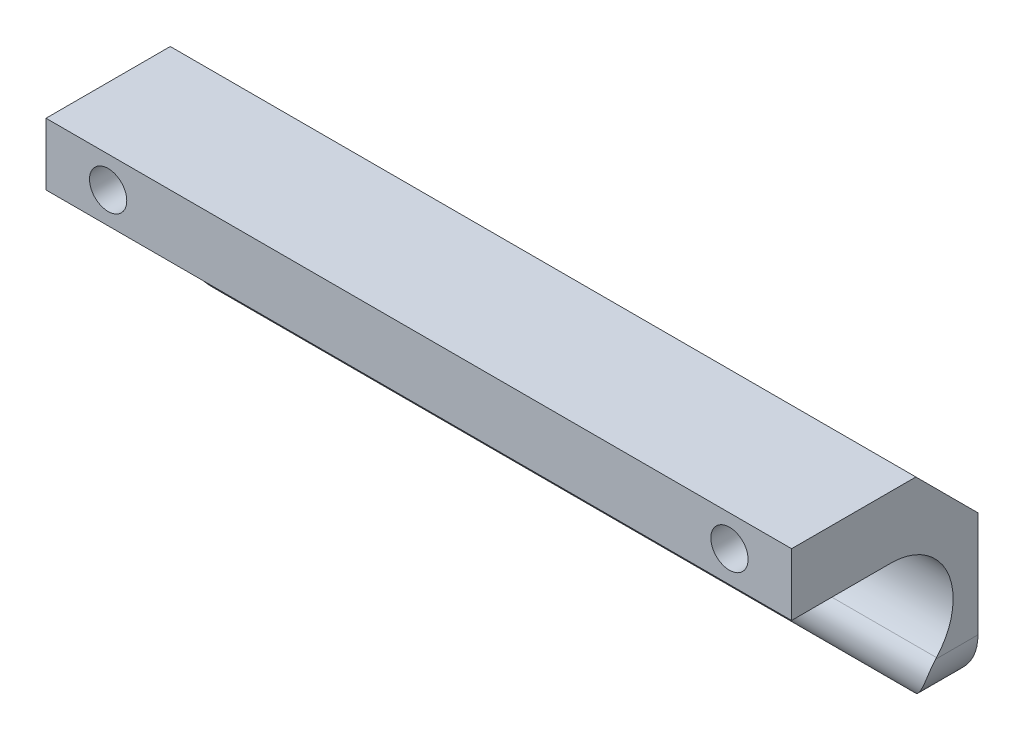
SolidWorks part; units mm, degrees
ref_plane "Front Plane" through (0, 0, 0) normal (0, 0, 1) x (1, 0, 0)
ref_plane "Top Plane" through (0, 0, 0) normal (0, 1, 0) x (1, 0, 0)
ref_plane "Right Plane" through (0, 0, 0) normal (1, 0, 0) x (0, 0, -1)
sketch "Sketch1" plane through (0, 0, 0) normal (1, 0, 0) x (0, 0, -1)
  line L1 (-15, -17.5) -> (15, -17.5)
  line L2 (-15, -17.5) -> (-15, 17.5)
  line L3 (-15, 17.5) -> (15, 17.5)
  line L4 (15, -17.5) -> (15, 17.5)
  line L5 (-15, -17.5) -> (15, 17.5) construction
  line L6 (-15, 17.5) -> (15, -17.5) construction
  point P0 (0, 0)
  dimension "D1" = 30
  dimension "D2" = 35
extrude "Extrude1" add sketch "Sketch1" along normal mid plane 120
chamfer "Chamfer1" distance 10 angle 45 1 edges at (0, 17.5, -15)
sketch "Sketch2" plane through (60, 0, 0) normal (1, 0, 0) x (0, 0, -1)
  line L0 (1, 7.5) -> (-15, 7.5)
  line L2 (-15, 17.5) -> (-15, -17.5) construction
  line L3 (5, 17.5) -> (-15, 17.5) construction
  line L4 (15, -17.5) -> (15, 7.5) construction
  line L7 (-15, -17.5) -> (15, -17.5) construction
  line L8 (15, -16.347) -> (15, -17.5)
  line L9 (15, -17.5) -> (-15, -17.5)
  line L10 (-15, -17.5) -> (-15, 7.5)
  arc A0 (8.3078, -9.3261) -> (15, -16.347) centre (11.8579, -12.6421) ccw
  arc A1 (8.3078, -9.3261) -> (1, 7.5) centre (1, -2.5) ccw
  point P3 (11, -2.5)
  point P16 (7, -12.6421)
  point P18 (11.8579, -17.5)
  dimension "D3" = 10
  dimension "D1" = 10
  dimension "D2" = 4
  dimension "D4" = 8
extrude "Extrude2" cut sketch "Sketch2" against normal blind 120 contours A0 A1 L0 M4 M5 | A0 L9 M1
sketch "Sketch3" plane through (0, 0, -15) normal (0, 0, -1) x (-1, 0, 0)
  line L0 (-60, -17.5) -> (-60, -9.5)
  line L1 (-60, -16.347) -> (-60, 7.5) construction
  line L2 (-60, -17.5) -> (60, -17.5) construction
  line L3 (-52, -17.5) -> (-60, -17.5)
  line L4 (60, -17.5) -> (60, -9.5)
  line L5 (60, -16.347) -> (60, 7.5) construction
  line L6 (60, -17.5) -> (52, -17.5)
  arc A0 (-60, -9.5) -> (-52, -17.5) centre (-52, -9.5) ccw
  arc A1 (52, -17.5) -> (60, -9.5) centre (52, -9.5) ccw
  dimension "D1" = 8
extrude "Extrude3" cut sketch "Sketch3" against normal through all
hole_wizard "M6x1.0 Tapped Hole1" positions "Sketch5" profile "Sketch4" tap size "M6x1.0" standard "Ansi Metric"
sketch "Sketch5" plane through (0, 0, 15) normal (0, 0, 1) x (1, 0, 0)
  line L0 (-60, 17.5) -> (-60, 7.5) construction
  line L1 (60, 17.5) -> (-60, 17.5) construction
  point P0 (-50, 12.5)
  point P2 (-60, 12.5)
  dimension "D1" = 10
  dimension "D2" = 5
sketch "Sketch4" plane through (-50, 12.5, 15) normal (1, 0, 0) x (0, -1, 0)
  line L0 (0, 0) -> (0, 18.5022)
  line L1 (0, 18.5022) -> (2.5, 17)
  line L2 (2.5, 17) -> (2.5, 12)
  line L3 (2.5, 12) -> (3, 12)
  line L4 (3, 12) -> (3, 0)
  line L5 (3, 0) -> (0, 0)
  line L10 (0, 18.5022) -> (-2.5, 17) construction
  line L11 (0, -6.35) -> (0, 107.95) construction
  dimension "Tap Drill Dia." = 5
  dimension "Tap Drill Depth" = 17
  dimension "Thread Major Dia." = 6
  dimension "Thread Depth" = 12
  dimension "Drill Angle" = 118
mirror "Mirror1" about plane through (0, 0, 0) normal (1, 0, 0) of "M6x1.0 Tapped Hole1"
